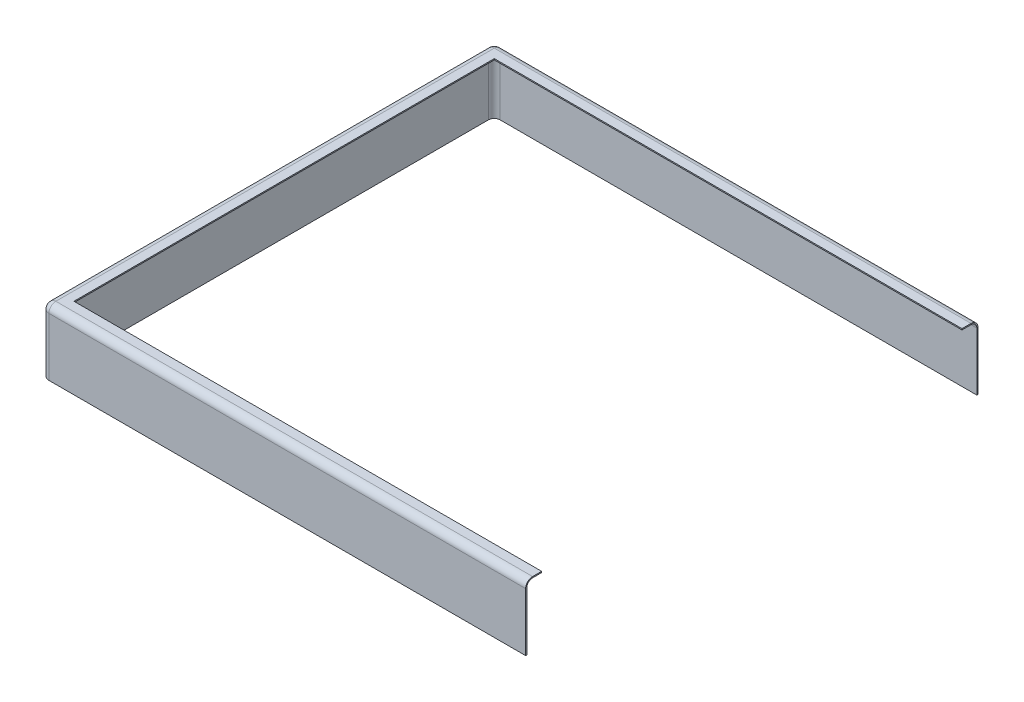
SolidWorks part; units mm, degrees
ref_plane "Спереди" through (0, 0, 0) normal (0, 0, 1) x (1, 0, 0)
ref_plane "Сверху" through (0, 0, 0) normal (0, 1, 0) x (1, 0, 0)
ref_plane "Справа" through (0, 0, 0) normal (1, 0, 0) x (0, 0, -1)
sketch "Эскиз1" plane through (0, 0, 0) normal (0, 0, 1) x (1, 0, 0)
  line L1 (0, 0) -> (2078, 0)
  line L2 (0, 0) -> (0, -275)
  line L3 (0, -275) -> (2078, -275)
  line L4 (2078, 0) -> (2078, -275)
  point P4 (0, 0)
  dimension "D1" = 275
  dimension "D2" = 2078
extrude "Бобышка-Вытянуть1" add sketch "Эскиз1" along normal blind 1938
sketch "Эскиз2" plane through (0, 0, 0) normal (0, 1, 0) x (1, 0, 0)
  line L0 (2078, -1938) -> (2078, 0) construction
  line L1 (2078, -64) -> (64, -64)
  line L2 (2078, -64) -> (2078, -1874)
  line L3 (2078, -1874) -> (64, -1874)
  line L4 (64, -64) -> (64, -1874)
  line L5 (2078, 0) -> (0, 0) construction
  line L6 (0, -1938) -> (0, 0) construction
  line L7 (2078, -1938) -> (0, -1938) construction
  point P6 (141.8003, -1723.2354)
  dimension "D1" = 64
  dimension "D2" = 64
  dimension "D3" = 64
extrude "Вырез-Вытянуть1" cut sketch "Эскиз2" against normal through all
fillet "Скругление1" radius 25 5 edges at (0, -137.5, 0) (0, 0, 969) (0, -137.5, 1938) (1039, 0, 1938) (1039, 0, 0)
shell "Оболочка1" thickness 5
